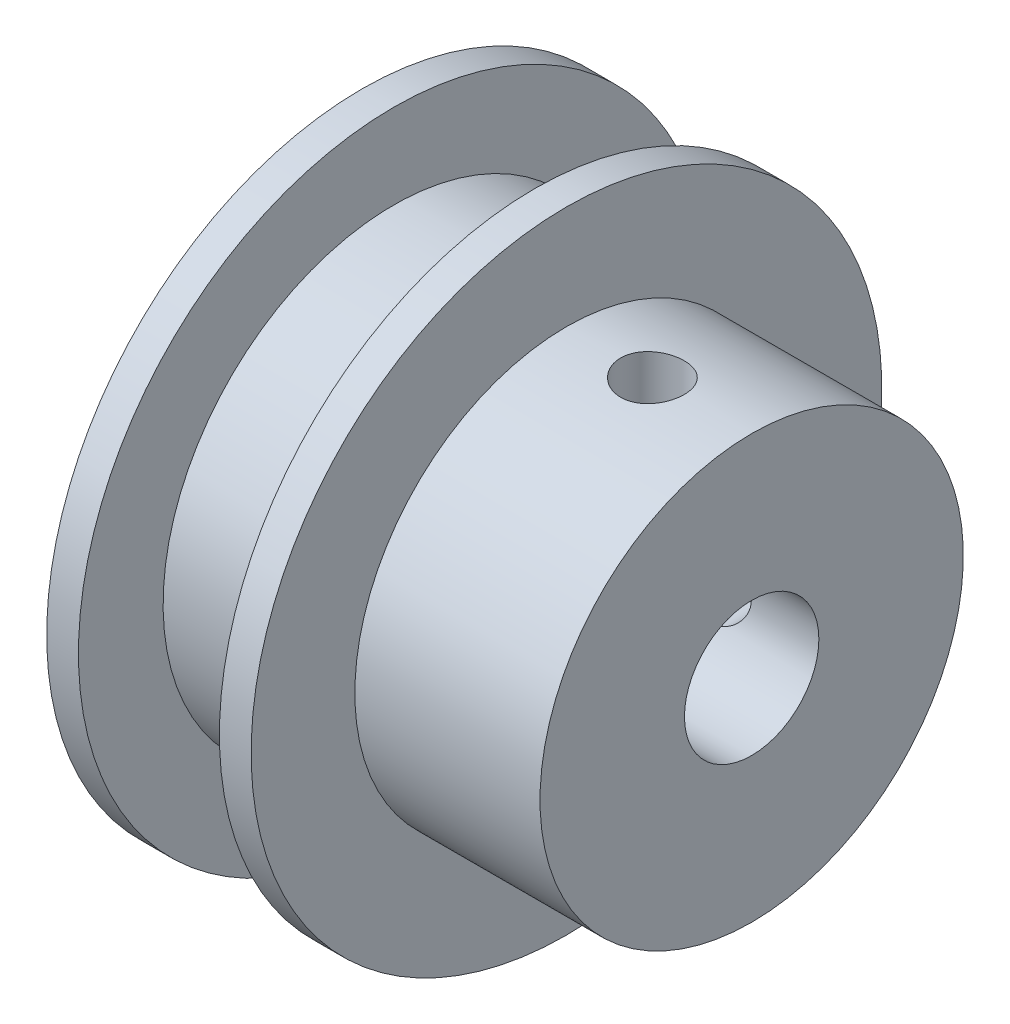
SolidWorks part; units mm, degrees
ref_plane "Front Plane" through (0, 0, 0) normal (0, 0, 1) x (1, 0, 0)
ref_plane "Top Plane" through (0, 0, 0) normal (0, 1, 0) x (1, 0, 0)
ref_plane "Right Plane" through (0, 0, 0) normal (1, 0, 0) x (0, 0, -1)
sketch "Sketch1" plane through (0, 0, 0) normal (0, 0, 1) x (1, 0, 0)
  line L0 (-3.33, 0) -> (3.33, 0)
  line L1 (-3.33, 0) -> (-3.33, 4)
  line L2 (-3.33, 4) -> (-4.83, 4)
  line L3 (-4.83, 4) -> (-4.83, -10.9)
  line L4 (-4.83, -10.9) -> (13.58, -10.9)
  line L5 (13.58, -10.9) -> (13.58, -0.9)
  line L6 (13.58, -0.9) -> (4.83, -0.9)
  line L7 (4.83, -0.9) -> (4.83, 4)
  line L8 (4.83, 4) -> (3.33, 4)
  line L9 (3.33, 4) -> (3.33, 0)
  point P4 (0, 0)
  dimension "D1" = 14.9
  dimension "D2" = 1.5
  dimension "D3" = 10
  dimension "D4" = 4
  dimension "D5" = 6.66
  dimension "D6" = 8.75
revolve "Revolve1" add sketch "Sketch1" angle 360 about L4
sketch "Sketch4" plane through (13.58, 0, 0) normal (1, 0, 0) x (0, 0, -1)
  line L0 (0, -0.9) -> (0, -10.9) construction
  circle A0 centre (0, -10.9) radius 10 construction
  circle A1 centre (0, -10.9) radius 3.175
  dimension "D1" = 6.35
extrude "Cut-Extrude1" cut sketch "Sketch4" against normal through all both and the other way through all
sketch "Sketch5" plane through (0, 0, 0) normal (0, 0, 1) x (1, 0, 0)
  line L0 (0, 0) -> (0, -10.9) construction
  line L1 (0, -10.9) -> (8.89, -10.9) construction
  circle A0 centre (8.89, -10.9) radius 1.5
  point P0 (9.3352, -10.9)
  point P6 (10.169, -11.9904)
  dimension "D2" = 3
  dimension "D1" = 10.9
  dimension "D3" = 8.89
extrude "Cut-Extrude2" cut sketch "Sketch5" against normal up to surface (10 mm away)
sketch "Sketch8" plane through (0, 0, 0) normal (0, 1, 0) x (1, 0, 0)
  line L0 (0, 0) -> (8.89, 0) construction
  circle A0 centre (8.89, 0) radius 1.5
  dimension "D2" = 3
  dimension "D1" = 8.89
extrude "Cut-Extrude3" cut sketch "Sketch8" against normal up to surface (8.1017 mm away)
